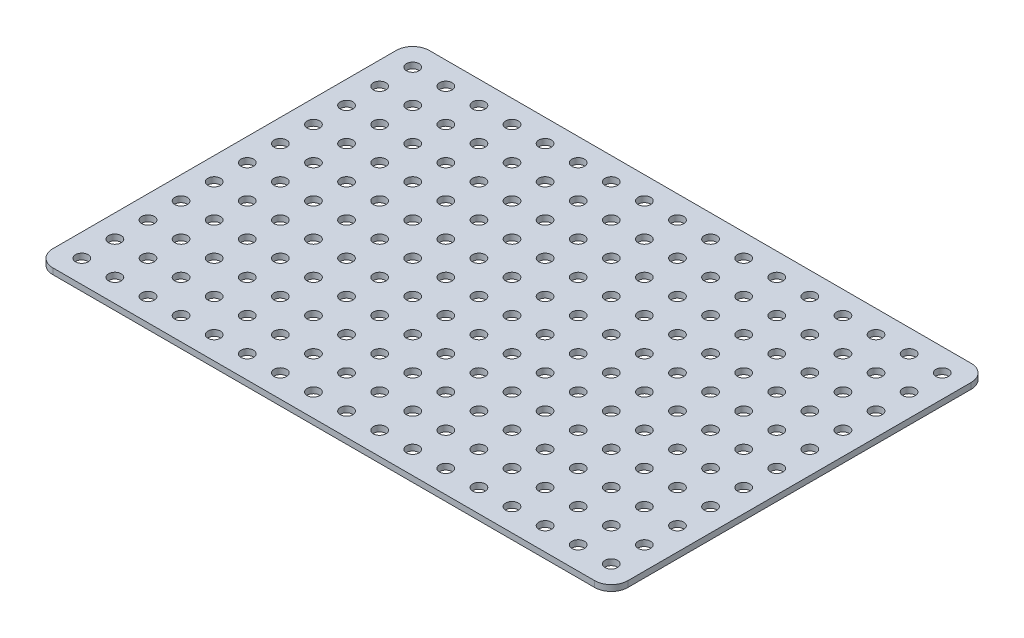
SolidWorks part; units mm, degrees
ref_plane "Front" through (0, 0, 0) normal (0, 0, 1) x (1, 0, 0)
ref_plane "Top" through (0, 0, 0) normal (0, 1, 0) x (1, 0, 0)
ref_plane "Right" through (0, 0, 0) normal (1, 0, 0) x (0, 0, -1)
sketch "Sketch1" plane through (0, 0, 0) normal (0, 1, 0) x (1, 0, 0)
  line L1 (6.35, -72.2376) -> (214.3252, -72.2376)
  line L2 (0, -65.8876) -> (0, 65.8876)
  line L3 (6.35, 72.2376) -> (214.3252, 72.2376)
  line L4 (220.6752, -65.8876) -> (220.6752, 65.8876)
  arc A0 (214.3252, -72.2376) -> (220.6752, -65.8876) centre (214.3252, -65.8876) ccw
  arc A1 (214.3252, 72.2376) -> (220.6752, 65.8876) centre (214.3252, 65.8876) cw
  arc A2 (0, 65.8876) -> (6.35, 72.2376) centre (6.35, 65.8876) cw
  arc A3 (6.35, -72.2376) -> (0, -65.8876) centre (6.35, -65.8876) cw
  dimension "D1" = 6.35
  dimension "D2" = 220.6752
  dimension "D3" = 144.4752
extrude "Extrude1" add sketch "Sketch1" along normal blind 2.286
sketch "Sketch2" plane through (0, 2.286, 0) normal (0, 1, 0) x (-1, 0, 0)
  line L0 (-6.35, 72.2376) -> (-214.3252, 72.2376) construction
  line L1 (0, -65.8876) -> (0, 65.8876) construction
  circle A0 centre (-8.7376, 63.5) radius 2.413
  dimension "D3" = 4.826
  dimension "D1" = 8.7376
  dimension "D2" = 8.7376
extrude "Cut-Extrude1" cut sketch "Sketch2" against normal through all
pattern_linear "LPattern1" count 17 spacing 12.7 along (1, 0, 0) count 11 spacing 12.7 along (0, 0, -1) of "Cut-Extrude1"
